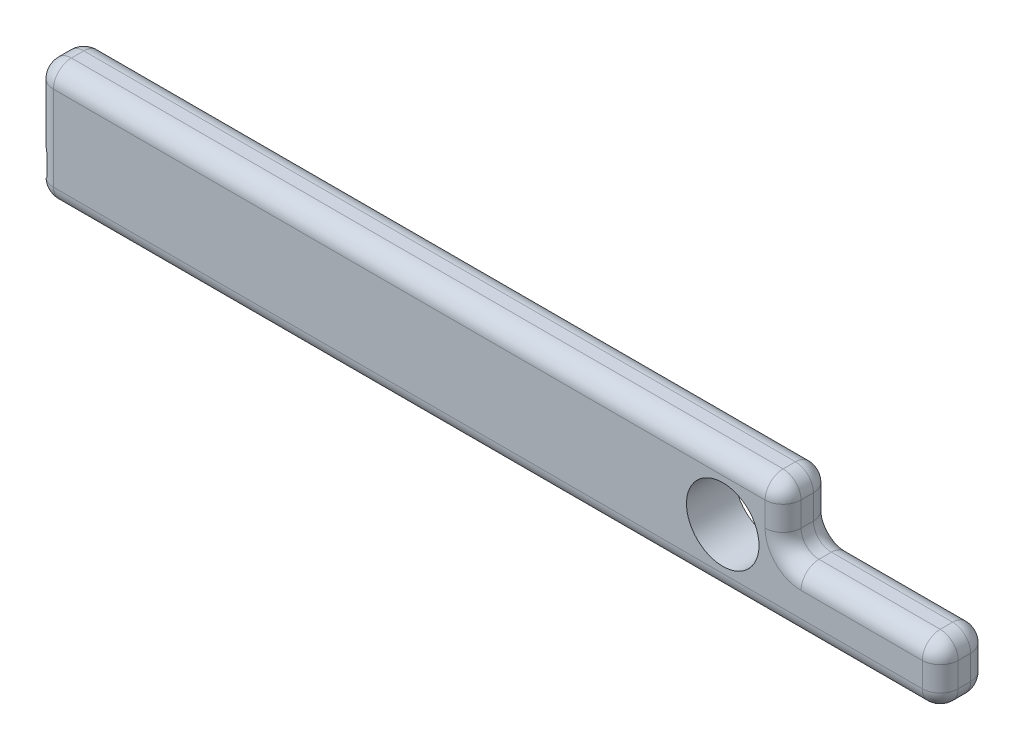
SolidWorks part; units mm, degrees
ref_plane "Front" through (0, 0, 0) normal (0, 0, 1) x (1, 0, 0)
ref_plane "Top" through (0, 0, 0) normal (0, 1, 0) x (1, 0, 0)
ref_plane "Right" through (0, 0, 0) normal (1, 0, 0) x (0, 0, -1)
sketch "Sketch1" plane through (0, 0, 0) normal (0, 0, 1) x (1, 0, 0)
  line L1 (-90.297, -7.9502) -> (28.575, -7.9502)
  line L2 (-90.297, -7.9502) -> (-90.297, 7.9248)
  line L3 (-90.297, 7.9248) -> (28.575, 7.9248)
  line L4 (28.575, -7.9502) -> (28.575, 7.9248)
  circle A0 centre (0, 0) radius 4.7625
  dimension "D5" = 9.525
  dimension "D1" = 118.872
  dimension "D2" = 28.575
  dimension "D3" = 15.875
  dimension "D4" = 7.9248
extrude "Extrude1" add sketch "Sketch1" along normal mid plane 6.35
sketch "Sketch2" plane through (0, 7.9248, 0) normal (0, 1, 0) x (-1, 0, 0)
  line L1 (-7.9248, -12.7) -> (-33.3248, -12.7)
  line L2 (-7.9248, -12.7) -> (-7.9248, 12.7)
  line L3 (-7.9248, 12.7) -> (-33.3248, 12.7)
  line L4 (-33.3248, -12.7) -> (-33.3248, 12.7)
  dimension "D1" = 7.9248
  dimension "D2" = 25.4
  dimension "D3" = 25.4
  dimension "D4" = 12.7
extrude "Cut-Extrude1" cut sketch "Sketch2" against normal blind 7.9248
fillet "Fillet1" radius 2.3622 7 edges at (18.2499, 0, -3.175) (28.575, 0, 0) (18.2499, 0, 3.175) (7.9248, 3.9624, 3.175) (7.9248, 7.9248, 0) (7.9248, 3.9624, -3.175) (7.9248, 0, 0)
fillet "Fillet4" radius 2.3622 1 edges at (-90.297, 7.9248, 0)
fillet "Fillet5" radius 2.3622 4 edges at (-41.1861, 7.9248, -3.175) (7.2329, 7.2329, -2.4831) (-90.297, -1.1938, -3.175) (-89.6051, 7.2329, -3.175)
fillet "Fillet6" radius 2.3622 4 edges at (-41.1861, 7.9248, 3.175) (7.2329, 7.2329, 2.4831) (-90.297, -1.1938, 3.175) (-89.6051, 7.2329, 3.175)
fillet "Fillet7" radius 2.3622 1 edges at (28.575, -7.9502, 0)
fillet "Fillet8" radius 2.3622 11 edges at (27.8831, -0.6919, 2.4831) (27.8831, -0.6919, -2.4831) (-30.861, -7.9502, -3.175) (-89.6051, -7.9502, -2.4831) (-30.861, -7.9502, 3.175) (-90.297, -7.9502, 0) (-89.6051, -7.9502, 2.4831) (28.575, -3.9751, -3.175) (28.575, -3.9751, 3.175) (27.8831, -7.2583, 3.175) (27.8831, -7.2583, -3.175)
sketch "Sketch4" plane through (-90.297, 0, 0) normal (-1, 0, 0) x (0, 0, 1)
  circle A0 centre (0, -3.81) radius 2.54
  dimension "D1" = 5.08
  dimension "D2" = 3.81
extrude "Cut-Extrude2" cut sketch "Sketch4" against normal blind 9.525
sketch "Sketch5" plane through (-90.297, 0, 0) normal (-1, 0, 0) x (0, 0, 1)
  circle A0 centre (0, -3.8149) radius 3.175
  dimension "D1" = 6.35
extrude "Cut-Extrude3" cut sketch "Sketch5" against normal blind 1.27
